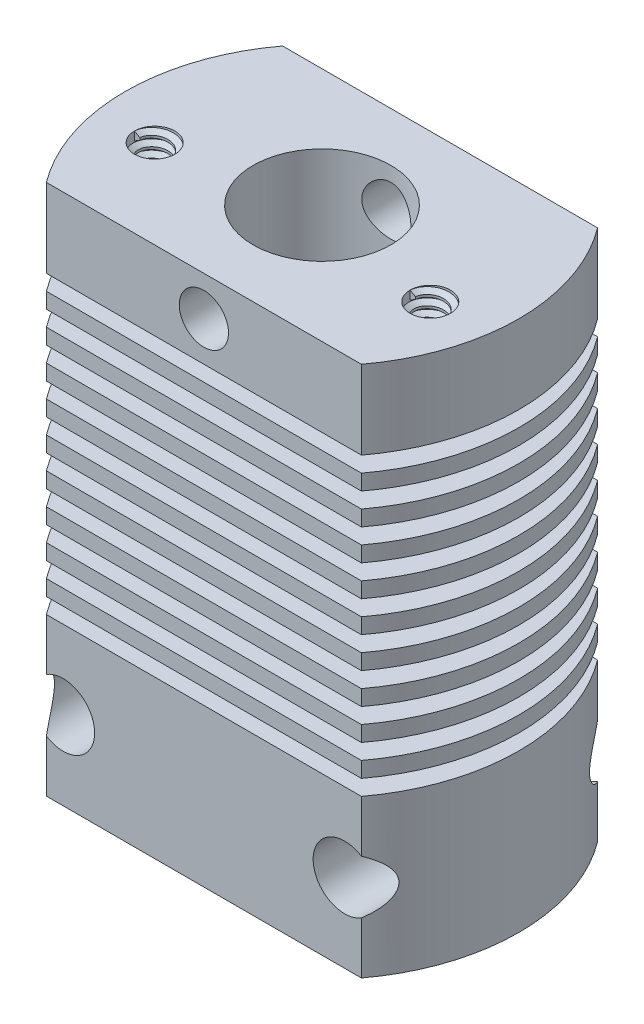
SolidWorks part; units mm, degrees
ref_plane "Alzado" through (0, 0, 0) normal (0, 0, 1) x (1, 0, 0)
ref_plane "Planta" through (0, 0, 0) normal (0, 1, 0) x (1, 0, 0)
ref_plane "Vista lateral" through (0, 0, 0) normal (1, 0, 0) x (0, 0, -1)
sketch "Croquis1" plane through (0, 0, 0) normal (0, 1, 0) x (1, 0, 0)
  line L1 (-10, -6) -> (10, -6)
  line L2 (-10, -6) -> (-10, 6)
  line L3 (-10, 6) -> (10, 6)
  line L4 (10, -6) -> (10, 6)
  line L5 (-10, -6) -> (10, 6) construction
  line L6 (-10, 6) -> (10, -6) construction
  circle A0 centre (0, 0) radius 3.5
  point P0 (0, 0)
  dimension "D3" = 7
  dimension "D1" = 20
  dimension "D2" = 12
extrude "Saliente-Extruir1" add sketch "Croquis1" along normal blind 27
sketch "Croquis3" plane through (0, 27, 0) normal (0, 1, 0) x (1, 0, 0)
  line L0 (10, -6) -> (10, 6) construction
  circle A0 centre (0, 0) radius 10
extrude "Cortar-Extruir-Lámina1" cut sketch "Croquis3" against normal blind 27 thin
sketch "Croquis5" plane through (0, 0, 6) normal (0, 0, 1) x (1, 0, 0)
  line L0 (-10, 23) -> (-4.3, 23)
  line L1 (-10, 27) -> (-10, 0) construction
  line L2 (-4.3, 23) -> (-4.3, 22.2106)
  line L3 (-4.3, 22.2106) -> (-10, 22.2106)
  line L4 (-10, 22.2106) -> (-10, 23)
  line L5 (-8, 27) -> (8, 27) construction
  line L7 (4.3, 23) -> (10, 23)
  line L8 (10, 23) -> (10, 22.2106)
  line L9 (10, 22.2106) -> (4.3, 22.2106)
  line L10 (4.3, 22.2106) -> (4.3, 23)
  line L11 (4.3, 21.42) -> (10, 21.42)
  line L12 (10, 21.42) -> (10, 20.6306)
  line L13 (10, 20.6306) -> (4.3, 20.6306)
  line L14 (4.3, 20.6306) -> (4.3, 21.42)
  line L15 (4.3, 19.84) -> (10, 19.84)
  line L16 (10, 19.84) -> (10, 19.0506)
  line L17 (10, 19.0506) -> (4.3, 19.0506)
  line L18 (4.3, 19.0506) -> (4.3, 19.84)
  line L19 (4.3, 18.26) -> (10, 18.26)
  line L20 (10, 18.26) -> (10, 17.4706)
  line L21 (10, 17.4706) -> (4.3, 17.4706)
  line L22 (4.3, 17.4706) -> (4.3, 18.26)
  line L23 (4.3, 16.68) -> (10, 16.68)
  line L24 (10, 16.68) -> (10, 15.8906)
  line L25 (10, 15.8906) -> (4.3, 15.8906)
  line L26 (4.3, 15.8906) -> (4.3, 16.68)
  line L27 (4.3, 15.1) -> (10, 15.1)
  line L28 (10, 15.1) -> (10, 14.3106)
  line L29 (10, 14.3106) -> (4.3, 14.3106)
  line L30 (4.3, 14.3106) -> (4.3, 15.1)
  line L31 (4.3, 13.52) -> (10, 13.52)
  line L32 (10, 13.52) -> (10, 12.7306)
  line L33 (10, 12.7306) -> (4.3, 12.7306)
  line L34 (4.3, 12.7306) -> (4.3, 13.52)
  line L35 (4.3, 11.94) -> (10, 11.94)
  line L36 (10, 11.94) -> (10, 11.1506)
  line L37 (10, 11.1506) -> (4.3, 11.1506)
  line L39 (4.3, 11.1506) -> (4.3, 11.94)
  line L40 (4.3, 10.36) -> (10, 10.36)
  line L41 (10, 10.36) -> (10, 9.5706)
  line L42 (10, 9.5706) -> (4.3, 9.5706)
  line L43 (4.3, 9.5706) -> (4.3, 10.36)
  line L45 (4.3, 8.78) -> (10, 8.78)
  line L46 (10, 8.78) -> (10, 7.9906)
  line L47 (10, 7.9906) -> (4.3, 7.9906)
  line L48 (4.3, 7.9906) -> (4.3, 8.78)
  line L49 (-10, 21.42) -> (-4.3, 21.42)
  line L50 (-4.3, 21.42) -> (-4.3, 20.6306)
  line L51 (-4.3, 20.6306) -> (-10, 20.6306)
  line L52 (-10, 20.6306) -> (-10, 21.42)
  line L53 (-10, 19.84) -> (-4.3, 19.84)
  line L54 (-4.3, 19.84) -> (-4.3, 19.0506)
  line L55 (-4.3, 19.0506) -> (-10, 19.0506)
  line L56 (-10, 19.0506) -> (-10, 19.84)
  line L57 (-10, 18.26) -> (-4.3, 18.26)
  line L58 (-4.3, 18.26) -> (-4.3, 17.4706)
  line L59 (-4.3, 17.4706) -> (-10, 17.4706)
  line L60 (-10, 17.4706) -> (-10, 18.26)
  line L61 (-10, 16.68) -> (-4.3, 16.68)
  line L62 (-4.3, 16.68) -> (-4.3, 15.8906)
  line L63 (-4.3, 15.8906) -> (-10, 15.8906)
  line L64 (-10, 15.8906) -> (-10, 16.68)
  line L65 (-10, 15.1) -> (-4.3, 15.1)
  line L66 (-4.3, 15.1) -> (-4.3, 14.3106)
  line L67 (-4.3, 14.3106) -> (-10, 14.3106)
  line L68 (-10, 14.3106) -> (-10, 15.1)
  line L69 (-10, 13.52) -> (-4.3, 13.52)
  line L70 (-4.3, 13.52) -> (-4.3, 12.7306)
  line L71 (-4.3, 12.7306) -> (-10, 12.7306)
  line L72 (-10, 12.7306) -> (-10, 13.52)
  line L73 (-10, 11.94) -> (-4.3, 11.94)
  line L74 (-4.3, 11.94) -> (-4.3, 11.1506)
  line L75 (-4.3, 11.1506) -> (-10, 11.1506)
  line L76 (-10, 11.1506) -> (-10, 11.94)
  line L77 (-10, 10.36) -> (-4.3, 10.36)
  line L78 (-4.3, 10.36) -> (-4.3, 9.5706)
  line L79 (-4.3, 9.5706) -> (-10, 9.5706)
  line L80 (-10, 9.5706) -> (-10, 10.36)
  line L81 (-10, 8.78) -> (-4.3, 8.78)
  line L82 (-4.3, 8.78) -> (-4.3, 7.9906)
  line L83 (-4.3, 7.9906) -> (-10, 7.9906)
  line L84 (-10, 7.9906) -> (-10, 8.78)
  dimension "D1" = 5.7
  dimension "D2" = 4
  dimension "D3" = 0.7894
  dimension "D5" = 10
  dimension "D4" = 2
extrude "Cortar-Extruir2" cut sketch "Croquis5" against normal blind 27
thread "Rosca1" pitch 1 start angle 0, offset 0, length 0, pitch 1, diameter 7
ref_plane "Plano1" through (3.5, 0, 0) normal (0, 0, 1) x (1, 0, 0)
sketch "Perfil de rosca1" plane through (3.5, 0, 0) normal (0, 0, 1) x (1, 0, 0)
  line L0 (0, 0) -> (0, 1) construction
  line L11 (0, 0) -> (0, 0.875)
  line L12 (0, 0.875) -> (-0.5413, 0.5625)
  line L13 (-0.5413, 0.5625) -> (-0.5413, 0.3125)
  line L15 (-0.5413, 0.3125) -> (0, 0)
  line L17 (-0.5413, 0.4375) -> (0, 0.4375) construction
  point P2 (0, 0)
  dimension "Pitch" = 1
  dimension "Profile_Angle" = 60
  dimension "Profile_Land" = 0.25
  dimension "Profile_Height" = 0.5413
sketch "Croquis4" plane through (0, 0, 6) normal (0, 0, 1) x (1, 0, 0)
  line L0 (-8, 0) -> (8, 0) construction
  line L1 (-8, 27) -> (8, 27) construction
  circle A0 centre (-7.15, 4) radius 1.6
  circle A1 centre (7.15, 4) radius 1.6
  circle A2 centre (0, 25) radius 1.25
  dimension "D1" = 3.2
  dimension "D2" = 14.3
  dimension "D5" = 2.5
  dimension "D3" = 4
  dimension "D4" = 7.15
  dimension "D6" = 2
extrude "Cortar-Extruir1" cut sketch "Croquis4" against normal blind 27
sketch "Croquis8" plane through (0, 27, 0) normal (0, 1, 0) x (1, 0, 0)
  circle A0 centre (-7, -1.5) radius 1.025
  circle A1 centre (7, -1.5) radius 1.025
  dimension "D1" = 14
  dimension "D3" = 2.05
  dimension "D2" = 7
  dimension "D4" = 1.5
extrude "Cortar-Extruir3" cut sketch "Croquis8" against normal blind 5
thread "Rosca2" pitch 0.5 start angle 0, offset 0, length 0, pitch 0.5, diameter 2.05
ref_plane "Plano2" through (-8.025, 27, 1.5) normal (0, 0, 1) x (-1, 0, 0)
sketch "Perfil de rosca2" plane through (-8.025, 27, 1.5) normal (0, 0, 1) x (-1, 0, 0)
  line L0 (0, 0) -> (0, 0.5) construction
  line L11 (0, 0) -> (0, 0.4375)
  line L12 (0, 0.4375) -> (-0.2706, 0.2812)
  line L13 (-0.2706, 0.2812) -> (-0.2706, 0.1562)
  line L15 (-0.2706, 0.1562) -> (0, 0)
  line L17 (-0.2706, 0.2187) -> (0, 0.2187) construction
  point P2 (0, 0)
  dimension "Pitch" = 0.5
  dimension "Profile_Angle" = 60
  dimension "Profile_Land" = 0.125
  dimension "Profile_Height" = 0.2706
thread "Rosca3" pitch 0.5 start angle 0, offset 0, length 0, pitch 0.5, diameter 2.05
ref_plane "Plano3" through (5.975, 27, 1.5) normal (0, 0, 1) x (-1, 0, 0)
sketch "Perfil de rosca3" plane through (5.975, 27, 1.5) normal (0, 0, 1) x (-1, 0, 0)
  line L0 (0, 0) -> (0, 0.5) construction
  line L11 (0, 0) -> (0, 0.4375)
  line L12 (0, 0.4375) -> (-0.2706, 0.2812)
  line L13 (-0.2706, 0.2812) -> (-0.2706, 0.1562)
  line L15 (-0.2706, 0.1562) -> (0, 0)
  line L17 (-0.2706, 0.2187) -> (0, 0.2187) construction
  point P2 (0, 0)
  dimension "Pitch" = 0.5
  dimension "Profile_Angle" = 60
  dimension "Profile_Land" = 0.125
  dimension "Profile_Height" = 0.2706
sketch "Croquis9" plane through (0, 23, 0) normal (0, -1, 0) x (1, 0, 0)
  circle A0 centre (0, 0) radius 4.4
  dimension "D1" = 8.8
extrude "Cortar-Extruir-Lámina2" cut sketch "Croquis9" along normal up to surface (0.7894 mm away) thin
sketch "Croquis10" plane through (0, 0, 0) normal (0, 0, 1) x (1, 0, 0)
  line L0 (0, 0) -> (0, 27) construction
  line L1 (8, 0) -> (-8, 0) construction
  line L2 (8, 27) -> (-8, 27) construction
  line L3 (4.3, 22.2106) -> (4.3, 23)
  line L4 (8, 23) -> (-8, 23) construction
  line L5 (-4.3, 23) -> (4.3, 23) construction
  line L6 (4.3, 23) -> (10, 23)
  line L7 (10, 23) -> (10, 22.2106)
  line L8 (10, 22.2106) -> (8, 22.2106) construction
  line L9 (10, 22.2106) -> (4.3, 22.2106)
  line L10 (4.3, 21.42) -> (10, 21.42)
  line L11 (4.3, 20.6306) -> (4.3, 21.42)
  line L12 (10, 20.6306) -> (4.3, 20.6306)
  line L13 (10, 21.42) -> (10, 20.6306)
  line L14 (4.3, 19.84) -> (10, 19.84)
  line L15 (4.3, 19.0506) -> (4.3, 19.84)
  line L16 (10, 19.0506) -> (4.3, 19.0506)
  line L17 (10, 19.84) -> (10, 19.0506)
  line L18 (4.3, 18.26) -> (10, 18.26)
  line L19 (4.3, 17.4706) -> (4.3, 18.26)
  line L20 (10, 17.4706) -> (4.3, 17.4706)
  line L21 (10, 18.26) -> (10, 17.4706)
  line L22 (4.3, 16.68) -> (10, 16.68)
  line L23 (4.3, 15.8906) -> (4.3, 16.68)
  line L24 (10, 15.8906) -> (4.3, 15.8906)
  line L25 (10, 16.68) -> (10, 15.8906)
  line L26 (4.3, 15.1) -> (10, 15.1)
  line L27 (4.3, 14.3106) -> (4.3, 15.1)
  line L28 (10, 14.3106) -> (4.3, 14.3106)
  line L29 (10, 15.1) -> (10, 14.3106)
  line L30 (4.3, 13.52) -> (10, 13.52)
  line L31 (4.3, 12.7306) -> (4.3, 13.52)
  line L32 (10, 12.7306) -> (4.3, 12.7306)
  line L33 (10, 13.52) -> (10, 12.7306)
  line L34 (4.3, 11.94) -> (10, 11.94)
  line L35 (4.3, 11.1506) -> (4.3, 11.94)
  line L36 (10, 11.1506) -> (4.3, 11.1506)
  line L37 (10, 11.94) -> (10, 11.1506)
  line L38 (4.3, 10.36) -> (10, 10.36)
  line L39 (4.3, 9.5706) -> (4.3, 10.36)
  line L40 (10, 9.5706) -> (4.3, 9.5706)
  line L41 (10, 10.36) -> (10, 9.5706)
  line L42 (4.3, 8.78) -> (10, 8.78)
  line L43 (4.3, 7.9906) -> (4.3, 8.78)
  line L44 (10, 7.9906) -> (4.3, 7.9906)
  line L45 (10, 8.78) -> (10, 7.9906)
  dimension "D1" = 10
revolve "Cortar-Revolución1" cut sketch "Croquis10" angle 360 about L0
